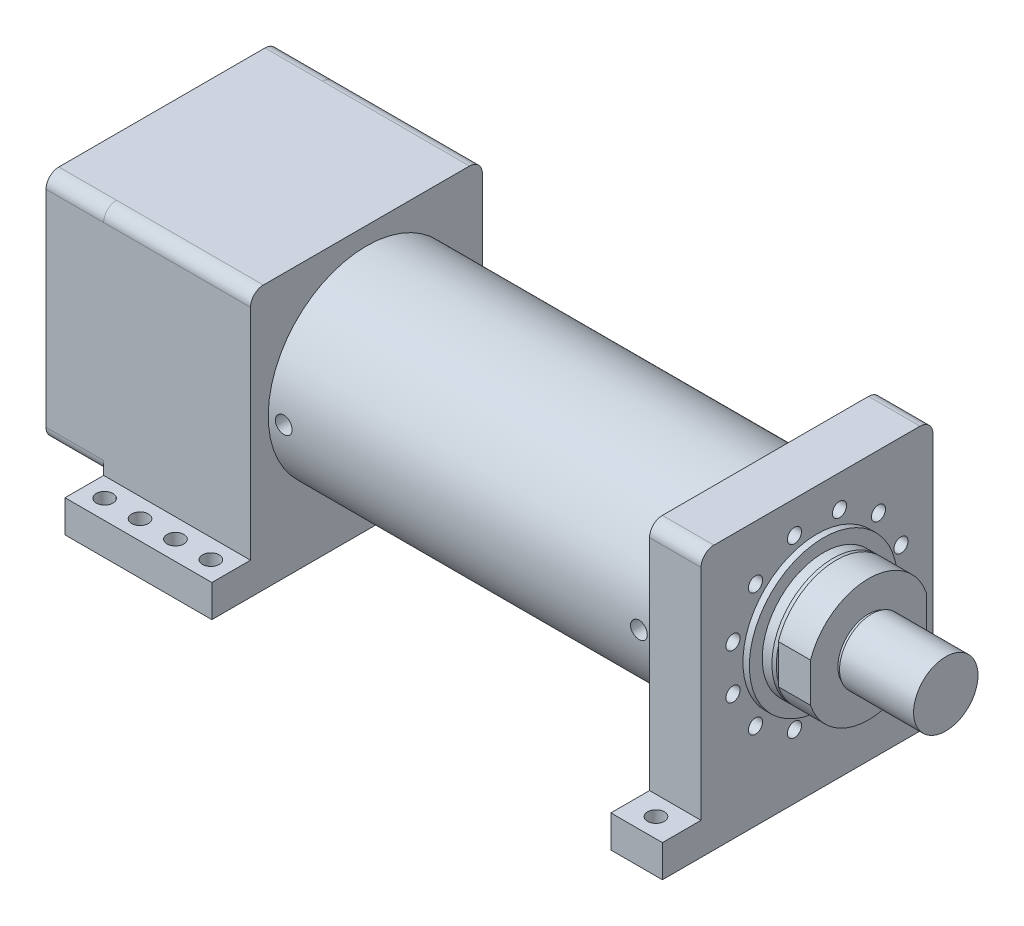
SolidWorks part; units mm, degrees
ref_plane "前视基准面" through (0, 0, 0) normal (0, 0, 1) x (1, 0, 0)
ref_plane "上视基准面" through (0, 0, 0) normal (0, 1, 0) x (1, 0, 0)
ref_plane "右视基准面" through (0, 0, 0) normal (1, 0, 0) x (0, 0, -1)
sketch "草图2" plane through (0, 0, 0) normal (0, 0, 1) x (1, 0, 0)
  line L0 (0, 0) -> (0, 152.5)
  line L1 (0, 152.5) -> (619.5, 152.5)
  line L6 (619.5, 152.5) -> (619.5, 0)
  line L7 (619.5, 0) -> (0, 0)
  dimension "D1" = 152.5
  dimension "D4" = 619.5
revolve "旋转1" add sketch "草图2" angle 360 about L7
sketch "草图3" plane through (619.5, 0, 0) normal (1, 0, 0) x (0, 0, -1)
  line L0 (0, 0) -> (232.7364, 0) construction
  line L1 (0, 0) -> (226.3775, 60.6577) construction
  line L3 (-180, 180) -> (180, 180)
  line L4 (-180, 180) -> (-180, -180)
  line L5 (-180, -180) -> (180, -180)
  line L6 (180, 180) -> (180, -180)
  line L7 (-180, 180) -> (180, -180) construction
  line L8 (-180, -180) -> (180, 180) construction
  circle A0 centre (0, 0) radius 180 construction
  circle A1 centre (0, 0) radius 135 construction
  circle A2 centre (130.4, 34.9406) radius 11
  circle A3 centre (130.4, -34.9406) radius 11
  circle A4 centre (95.4594, -95.4594) radius 11
  circle A5 centre (34.9406, -130.4) radius 11
  circle A6 centre (-34.9406, -130.4) radius 11
  circle A7 centre (-95.4594, -95.4594) radius 11
  circle A8 centre (-130.4, -34.9406) radius 11
  circle A9 centre (-130.4, 34.9406) radius 11
  circle A10 centre (-95.4594, 95.4594) radius 11
  circle A11 centre (-34.9406, 130.4) radius 11
  circle A12 centre (34.9406, 130.4) radius 11
  circle A13 centre (95.4594, 95.4594) radius 11
  point P32 (0, 0)
  dimension "D1" = 360
  dimension "D2" = 270
  dimension "D4" = 22
  dimension "D3" = 15
  dimension "D6" = 360
  dimension "D7" = 360
  dimension "D5" = 12
extrude "凸台-拉伸1" add sketch "草图3" along normal blind 80
ref_plane "基准面1" through (0, 0, 152.5) normal (0, 0, 1) x (1, 0, 0)
ref_plane "基准面2" through (0, 0, -152.5) normal (0, 0, 1) x (1, 0, 0)
sketch "草图17" plane through (0, 0, -152.5) normal (0, 0, 1) x (1, 0, 0)
  circle A0 centre (44, 0) radius 13
  dimension "D1" = 26
  dimension "D2" = 44
extrude "切除-拉伸6" cut sketch "草图17" along normal blind 2
sketch "草图19" plane through (0, 0, 152.5) normal (0, 0, 1) x (1, 0, 0)
  circle A0 centre (24, 0) radius 13
  circle A1 centre (575.5, 0) radius 13
  dimension "D1" = 24
  dimension "D2" = 26
  dimension "D3" = 26
sketch "草图23" plane through (0, 0, 0) normal (-1, 0, 0) x (0, 0, 1)
  line L1 (-180, 180) -> (180, 180)
  line L2 (-180, 180) -> (-180, -180)
  line L3 (-180, -180) -> (180, -180)
  line L4 (180, 180) -> (180, -180)
  line L5 (-180, 180) -> (180, -180) construction
  line L6 (-180, -180) -> (180, 180) construction
  circle A0 centre (0, 0) radius 180 construction
  dimension "D1" = 360
  dimension "D2" = 360
  dimension "D3" = 360
extrude "凸台-拉伸8" add sketch "草图23" along normal blind 50
sketch "草图28" plane through (-50, 0, 0) normal (-1, 0, 0) x (0, 0, 1)
  line L1 (-180, 180) -> (180, 180)
  line L2 (-180, 180) -> (-180, -180)
  line L3 (-180, -180) -> (180, -180)
  line L4 (180, 180) -> (180, -180)
  line L5 (-180, 180) -> (180, -180) construction
  line L6 (-180, -180) -> (180, 180) construction
  point P0 (0, 0)
extrude "凸台-拉伸12" add sketch "草图28" along normal blind 178 separate body
sketch "草图29" plane through (-228, 0, 0) normal (-1, 0, 0) x (0, 0, 1)
  line L1 (-180, 180) -> (180, 180)
  line L2 (-180, 180) -> (-180, -180)
  line L3 (-180, -180) -> (180, -180)
  line L4 (180, 180) -> (180, -180)
  line L5 (-180, 180) -> (180, -180) construction
  line L6 (-180, -180) -> (180, 180) construction
  point P0 (0, 0)
extrude "凸台-拉伸13" add sketch "草图29" along normal blind 89.5 separate body
fillet "圆角3" radius 20 4 edges at (-272.75, -180, 180) (-272.75, 180, 180) (-272.75, -180, -180) (-272.75, 180, -180)
extrude "切除-拉伸9" cut sketch "草图19" against normal blind 100 contours A0 | A1
sketch "草图52" plane through (699.5, 0, 0) normal (1, 0, 0) x (0, 0, -1)
  circle A0 centre (0, 0) radius 115
  dimension "D1" = 230
extrude "凸台-拉伸38" add sketch "草图52" along normal blind 10 separate body
sketch "草图53" plane through (709.5, 0, 0) normal (1, 0, 0) x (0, 0, -1)
  circle A0 centre (0, 0) radius 95
  dimension "D1" = 190
extrude "凸台-拉伸39" add sketch "草图53" along normal blind 20 separate body
chamfer "倒角3" distance 5 angle 20 1 edges at (729.5, 0, -95)
sketch "草图54" plane through (729.5, 0, 0) normal (1, 0, 0) x (0, 0, -1)
  line L2 (-90, 30.4138) -> (-90, -30.4138)
  line L4 (90, 30.4138) -> (90, -30.4138)
  line L5 (-60.0473, 73.6161) -> (60.0473, -73.6161) construction
  line L6 (-60.0473, -73.6161) -> (60.0473, 73.6161) construction
  arc A0 (-90, -30.4138) -> (90, -30.4138) centre (0, 0) ccw
  arc A1 (90, 30.4138) -> (-90, 30.4138) centre (0, 0) ccw
  dimension "D1" = 190
extrude "凸台-拉伸40" add sketch "草图54" along normal blind 50 separate body
sketch "草图55" plane through (779.5, 0, 0) normal (1, 0, 0) x (0, 0, -1)
  circle A0 centre (0, 0) radius 47.5
  dimension "D1" = 95
extrude "凸台-拉伸41" add sketch "草图55" along normal blind 5
sketch "草图56" plane through (784.5, 0, 0) normal (1, 0, 0) x (0, 0, -1)
  circle A0 centre (0, 0) radius 50
  dimension "D1" = 100
extrude "凸台-拉伸42" add sketch "草图56" along normal blind 115
sketch "草图59" plane through (0, -180, 0) normal (0, -1, 0) x (1, 0, 0)
  line L0 (-228, 180) -> (-50, 180) construction
  line L1 (-228, 240) -> (0, 240)
  line L2 (-228, 240) -> (-228, -240)
  line L3 (-228, -240) -> (0, -240)
  line L4 (0, 240) -> (0, -240)
  line L5 (619.5, 240) -> (699.5, 240)
  line L6 (619.5, 240) -> (619.5, -240)
  line L7 (619.5, -240) -> (699.5, -240)
  line L8 (699.5, 240) -> (699.5, -240)
  line L9 (699.5, 180) -> (619.5, 180) construction
  line L10 (0, 0) -> (110.3333, 0) construction
  circle A0 centre (-196.5, 210) radius 13
  circle A1 centre (-141.5, 210) radius 13
  circle A2 centre (-86.5, 210) radius 13
  circle A3 centre (-31.5, 210) radius 13
  circle A4 centre (659.5, 210) radius 13
  circle A5 centre (659.5, -210) radius 13
  circle A6 centre (-31.5, -210) radius 13
  circle A7 centre (-86.5, -210) radius 13
  circle A8 centre (-141.5, -210) radius 13
  circle A9 centre (-196.5, -210) radius 13
  dimension "D6" = 26
  dimension "D7" = 26
  dimension "D8" = 26
  dimension "D9" = 26
  dimension "D14" = 26
  dimension "D1" = 480
  dimension "D2" = 60
  dimension "D3" = 55
  dimension "D4" = 55
  dimension "D5" = 55
  dimension "D10" = 210
  dimension "D11" = 31.5
  dimension "D12" = 480
  dimension "D13" = 60
  dimension "D15" = 210
  dimension "D16" = 40
extrude "凸台-拉伸43" add sketch "草图59" along normal blind 50
fillet "圆角7" radius 20 4 edges at (659.5, 180, -180) (659.5, 180, 180) (-114, 180, -180) (-114, 180, 180)
